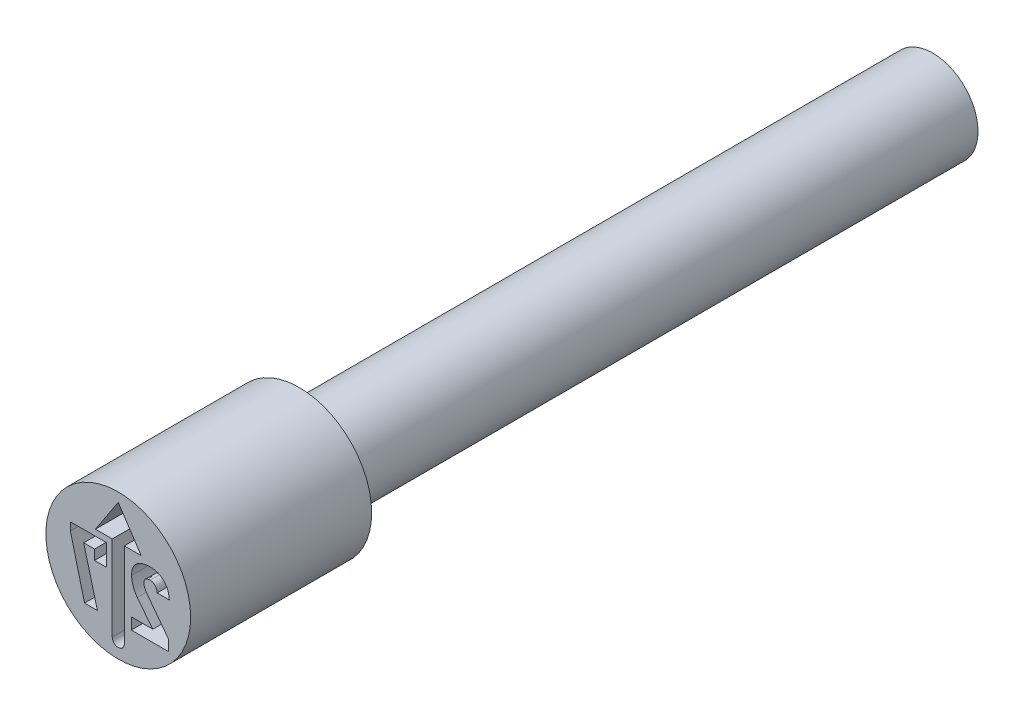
SolidWorks part; units mm, degrees
ref_plane "Front Plane" through (0, 0, 0) normal (0, 0, 1) x (1, 0, 0)
ref_plane "Top Plane" through (0, 0, 0) normal (0, 1, 0) x (1, 0, 0)
ref_plane "Right Plane" through (0, 0, 0) normal (1, 0, 0) x (0, 0, -1)
sketch "Sketch2" plane through (0, 0, 0) normal (1, 0, 0) x (0, 0, -1)
  line L0 (0.4039, 0) -> (50000.4039, 0) construction
  line L6 (0, 0.8) -> (0, 0)
  line L7 (2, 0.8) -> (0, 0.8)
  line L8 (2, 0.5) -> (2, 0.8)
  line L9 (9, 0.5) -> (2, 0.5)
  line L10 (9, 0) -> (9, 0.5)
  line L11 (0, 0) -> (9, 0)
  dimension "D1" = 1.6
  dimension "D2" = 1
  dimension "D3" = 9
  dimension "D4" = 2
revolve "Revolve1" add sketch "Sketch2" angle 360 about L0
sketch "Sketch3" plane through (0, 0, 0) normal (0, 0, 1) x (1, 0, 0)
  line L0 (0, 0) -> (0, 35000) construction
  line L1 (0.0667, 0.3172) -> (0.0667, -0.6217)
  line L2 (0.2527, 0.3172) -> (0.0667, 0.3172)
  line L3 (0, 0.7007) -> (0.2527, 0.3172)
  line L15 (0, 0.7007) -> (-0.2527, 0.3172)
  line L16 (-0.2527, 0.3172) -> (-0.0667, 0.3172)
  line L17 (-0.0667, 0.3172) -> (-0.0667, -0.6217)
  arc A2 (-0.0667, -0.6217) -> (0.0667, -0.6217) centre (0, -0.6217) ccw
extrude "Cut-Extrude4" cut sketch "Sketch3" against normal blind 0.3
sketch "Sketch4" plane through (0, 0, 0) normal (0, 0, 1) x (1, 0, 0)
  text T0 "2 7" font "Bahnschrift" height 0.7
  dimension "D2" = 0.45
extrude "Cut-Extrude5" cut sketch "Sketch4" against normal blind 0.3
